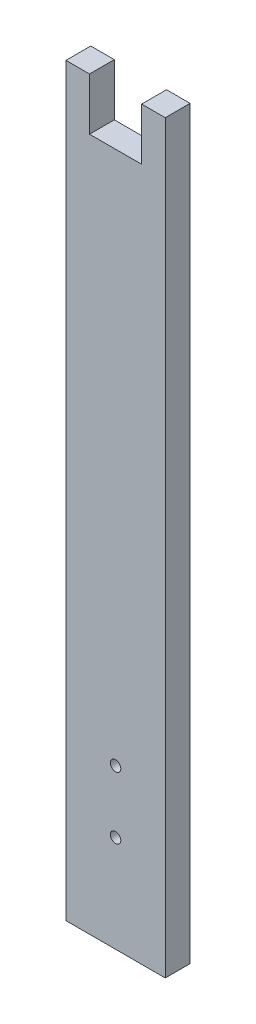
SolidWorks part; units mm, degrees
ref_plane "Front Plane" through (0, 0, 0) normal (0, 0, 1) x (1, 0, 0)
ref_plane "Top Plane" through (0, 0, 0) normal (0, 1, 0) x (1, 0, 0)
ref_plane "Right Plane" through (0, 0, 0) normal (1, 0, 0) x (0, 0, -1)
sketch "Sketch1" plane through (0, 0, 0) normal (0, 0, 1) x (1, 0, 0)
  line L0 (0, 328.1346) -> (0, -191.239) construction
  line L1 (-20, 300) -> (20, 300)
  line L2 (-20, 300) -> (-20, 0)
  line L3 (-20, 0) -> (20, 0)
  line L4 (20, 300) -> (20, 0)
  point P4 (0, 300)
  dimension "D1" = 40
  dimension "D2" = 300
extrude "Boss-Extrude1" add sketch "Sketch1" along normal blind 10
sketch "Sketch2" plane through (0, 0, 0) normal (0, 0, 1) x (1, 0, 0)
  line L0 (0, 308.8938) -> (0, 267.827) construction
  line L1 (12, 282) -> (-12, 282) construction
  line L2 (12, 282) -> (12, 258) construction
  line L3 (12, 258) -> (-12, 258) construction
  line L4 (-12, 282) -> (-12, 258) construction
  line L5 (17.8096, 270) -> (-29.5343, 270) construction
  circle A0 centre (12, 282) radius 1.5
  circle A1 centre (-12, 282) radius 1.5
  circle A2 centre (12, 258) radius 1.5
  circle A3 centre (-12, 258) radius 1.5
  dimension "D3" = 3
  dimension "D1" = 270
  dimension "D2" = 24
extrude "Cut-Extrude1" [suppressed] cut sketch "Sketch2" along normal through all
sketch "Sketch3" plane through (0, 0, 0) normal (0, 0, -1) x (-1, 0, 0)
  line L0 (20, 0) -> (-20, 0) construction
  line L1 (-33.7271, 72) -> (34.0046, 72) construction
  circle A0 centre (0, 64) radius 2.1
  circle A1 centre (0, 39) radius 2.1
  dimension "D4" = 25
  dimension "D5" = 4.2
  dimension "D1" = 72
  dimension "D3" = 8
extrude "Cut-Extrude2" cut sketch "Sketch3" against normal through all
sketch "Sketch4" plane through (0, 0, 0) normal (0, 0, 1) x (1, 0, 0)
  line L0 (0, 300) -> (0, 279) construction
  line L1 (-10.5, 300) -> (10.5, 300)
  line L2 (-10.5, 300) -> (-10.5, 279)
  line L3 (-10.5, 279) -> (10.5, 279)
  line L4 (10.5, 300) -> (10.5, 279)
  line L5 (-20, 300) -> (-20, 0) construction
  line L6 (20, 0) -> (20, 300) construction
  line L7 (20, 300) -> (-20, 300) construction
  dimension "D1" = 21
extrude "Cut-Extrude3" cut sketch "Sketch4" along normal through all
